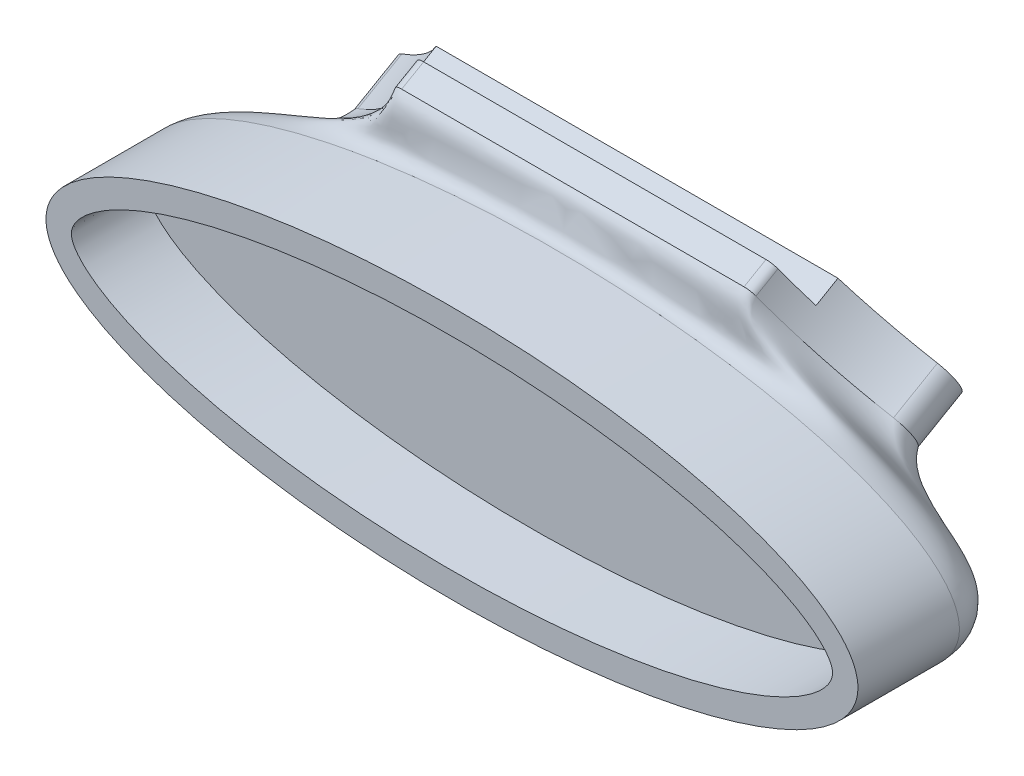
SolidWorks part; units mm, degrees
ref_plane "Ebene vorne" through (0, 0, 0) normal (0, 0, 1) x (1, 0, 0)
ref_plane "Ebene oben" through (0, 0, 0) normal (0, 1, 0) x (1, 0, 0)
ref_plane "Ebene rechts" through (0, 0, 0) normal (1, 0, 0) x (0, 0, -1)
sketch "Skizze1" plane through (0, 0, 0) normal (0, 0, 1) x (1, 0, 0)
  ellipse E0 centre (0, 0) end of major axis (-80, 0) minor radius 25
  dimension "D1" = 50
  dimension "D2" = 160
extrude "Linear austragen1" add sketch "Skizze1" along normal blind 20
sketch "Skizze8" plane through (0, 0, 20) normal (0, 0, 1) x (1, 0, 0)
  spline S0 degree 3 number of poles 133 (75, 0) -> (75, 0)
  spline S1 degree 3 number of poles 133 (75, 0) -> (75, 0)
  dimension "D1" = 5
extrude "Linear austragen2" cut sketch "Skizze8" against normal blind 15
sketch "Skizze2" plane through (0, 0, 0) normal (1, 0, 0) x (0, 0, -1)
  line L0 (0, 0) -> (17.3205, 10) construction
  line L1 (11, 0) -> (-11, 0) construction
  dimension "D1" = 30
  dimension "D2" = 20
ref_plane "Ebene1" through (0, 10, -17.3205) normal (0, 0.5, -0.866) x (-1, 0, 0)
sketch "Skizze3" plane through (0, 10, -17.3205) normal (0, 0.5, -0.866) x (-1, 0, 0)
  line L0 (-35, 27) -> (35, 27)
  line L1 (-50, -3) -> (50, -3)
  line L2 (0, -3) -> (0, 27) construction
  arc A0 (35, 27) -> (52.7705, 6.1623) centre (80.4751, 47.785) ccw
  arc A1 (52.7705, 6.1623) -> (50, -3) centre (50, 2) cw
  arc A2 (-52.7705, 6.1623) -> (-50, -3) centre (-50, 2) ccw
  arc A3 (-35, 27) -> (-52.7705, 6.1623) centre (-80.4751, 47.785) cw
  dimension "D1" = 5
  dimension "D4" = 50
  dimension "D2" = 70
  dimension "D3" = 100
  dimension "D5" = 30
  dimension "D6" = 3
extrude "Linear austragen3" add sketch "Skizze3" along normal blind 10
sketch "Skizze9" plane through (0, 15, -25.9808) normal (0, 0.5, -0.866) x (-1, 0, 0)
  line L0 (35, 27) -> (-35, 27) construction
  line L1 (35, 27) -> (-35, 27)
  line L2 (-39.5921, 19) -> (39.5921, 19)
  arc A0 (-52.7705, 6.1623) -> (-35, 27) centre (-80.4751, 47.785) ccw construction
  arc A1 (35, 27) -> (52.7705, 6.1623) centre (80.4751, 47.785) ccw construction
  arc A2 (-39.5921, 19) -> (-35, 27) centre (-80.4751, 47.785) ccw
  arc A3 (35, 27) -> (39.5921, 19) centre (80.4751, 47.785) ccw
  dimension "D1" = 8
extrude "Linear austragen4" cut sketch "Skizze9" against normal blind 5
fillet "Verrundung1" radius 2 2 edges at (-35, 34.6327, -5.9856) (35, 34.6327, -5.9856)
sketch "Skizze4" plane through (0, 0, 0) normal (1, 0, 0) x (0, 0, -1)
  line L0 (0, 25) -> (-20, 25) construction
  line L1 (0, 25) -> (-20, 25) construction
  line L2 (12.4808, 38.3827) -> (3.8205, 33.3827) construction
  line L3 (12.4808, 38.3827) -> (3.8205, 33.3827) construction
  spline S0 degree 3 poles (0, 25) (3.4725, 25) (1.1612, 31.8473) (3.8205, 33.3827) knots 0 0 0 0 1 1 1 1
sketch "Skizze5" plane through (0, 0, 0) normal (1, 0, 0) x (0, 0, -1)
  line L0 (-20, -25) -> (0, -25) construction
  line L1 (-20, -25) -> (0, -25) construction
  line L2 (27.4808, 12.4019) -> (18.8205, 7.4019) construction
  line L3 (27.4808, 12.4019) -> (18.8205, 7.4019) construction
  spline S0 degree 3 poles (0, -25) (13.6769, -25) (8.0035, 1.1567) (18.8205, 7.4019) knots 0 0 0 0 1 1 1 1
sketch "Skizze6" plane through (0, 0, 0) normal (0, 0, -1) x (-1, 0, 0)
  line L0 (0, 25) -> (0, -25) construction
  ellipse E1 centre (0, 0) end of major axis (80, 0) minor radius 25 (34.7691, 22.5154) -> (-34.7691, 22.5154) ccw
  ellipse E2 centre (0, 0) end of major axis (80, 0) minor radius 25
  ellipse E3 centre (0, 0) end of major axis (80, 0) minor radius 25 (-34.7691, 22.5154) -> (-66.175, -14.0482) ccw
  ellipse E4 centre (0, 0) end of major axis (80, 0) minor radius 25 (-66.175, -14.0482) -> (66.175, -14.0482) ccw
  ellipse E5 centre (0, 0) end of major axis (80, 0) minor radius 25 (66.175, -14.0482) -> (34.7691, 22.5154) ccw
  dimension "D1" = 0
sketch "Skizze7" plane through (0, 10, -17.3205) normal (0, -0.5, 0.866) x (1, 0, 0)
  line L2 (33.7328, 27) -> (-33.7328, 27)
  line L3 (-50, -3) -> (50, -3)
  line L4 (33.7328, 27) -> (-33.7328, 27)
  line L5 (-50, -3) -> (50, -3)
  arc A6 (-33.7328, 27) -> (-35.5306, 25.8763) centre (-33.7328, 25) ccw
  arc A7 (-52.7705, 6.1623) -> (-35.5306, 25.8763) centre (-80.4751, 47.785) ccw
  arc A8 (-52.7705, 6.1623) -> (-50, -3) centre (-50, 2) ccw
  arc A9 (50, -3) -> (52.7705, 6.1623) centre (50, 2) ccw
  arc A10 (35.5306, 25.8763) -> (52.7705, 6.1623) centre (80.4751, 47.785) ccw
  arc A11 (35.5306, 25.8763) -> (33.7328, 27) centre (33.7328, 25) ccw
  arc A12 (-33.7328, 27) -> (-35.5306, 25.8763) centre (-33.7328, 25) ccw
  arc A13 (-52.7705, 6.1623) -> (-35.5306, 25.8763) centre (-80.4751, 47.785) ccw
  arc A14 (-52.7705, 6.1623) -> (-50, -3) centre (-50, 2) ccw
  arc A15 (50, -3) -> (52.7705, 6.1623) centre (50, 2) ccw
  arc A16 (35.5306, 25.8763) -> (52.7705, 6.1623) centre (80.4751, 47.785) ccw
  arc A17 (35.5306, 25.8763) -> (33.7328, 27) centre (33.7328, 25) ccw
  point P0 (0, 26.3772)
  point P3 (22.214, 44.219)
  dimension "D1" = 0
sketch3d "3D-Skizze3"
  line L0 (-80, 0, 20) -> (-80, 0, 0)
  line L1 (80, 0, 0) -> (80, 0, 20)
  line L2 (80, 0, 0) -> (80, 0, 20) construction
  line L3 (-80, 0, 20) -> (-80, 0, 0) construction
  arc A0 (-50, 12.4019, -27.4808) -> (-52.7705, 20.3367, -22.8996) centre (-50, 16.7321, -24.9808) ccw construction
  arc A1 (-52.7705, 15.3367, -14.2394) -> (-50, 7.4019, -18.8205) centre (-50, 11.7321, -16.3205) ccw construction
  spline S0 degree 3 poles (-54.786, 15.4788, -25.7043) (-54.2124, 13.8064, -22.4939) (-51.7924, 6.7511, -8.9495) (-80, 0, -12.6909) (-80, 0, 0) knots 0 0 0 0 0.237036 1 1 1 1
  point P9 (-50, 19.2321, -29.3109)
  point P13 (-50, 9.2321, -11.9904)
  point P15 (-80, -57.2874, 98.1307)
sketch3d "3D-Skizze4"
  line L0 (80, 0, 0) -> (80, 0, 20) construction
  arc A0 (52.7705, 20.3367, -22.8996) -> (50, 12.4019, -27.4808) centre (50, 16.7321, -24.9808) ccw construction
  arc A1 (50, 7.4019, -18.8205) -> (52.7705, 15.3367, -14.2394) centre (50, 11.7321, -16.3205) ccw construction
  spline S0 degree 3 poles (54.786, 15.4788, -25.7043) (54.2124, 13.8064, -22.4939) (51.7924, 6.7511, -8.9495) (80, 0, -12.6909) (80, 0, 0) knots 0 0 0 0 0.237036 1 1 1 1
  point P9 (50, 19.2321, -29.3109)
  point P13 (50, 9.2321, -11.9904)
loft "Ausformung1" add profiles "Skizze6", "Skizze7"
